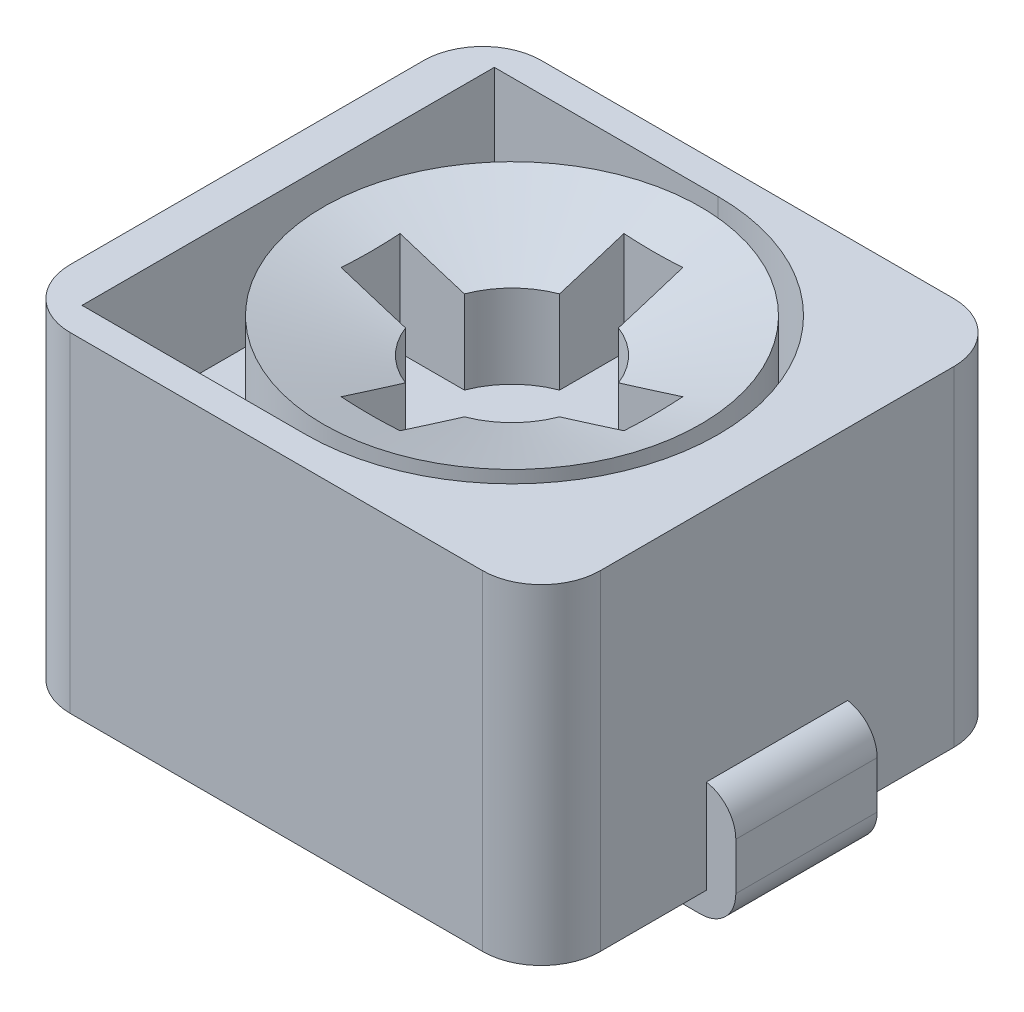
SolidWorks part; units mm, degrees
ref_plane "Front" through (0, 0, 0) normal (0, 0, 1) x (1, 0, 0)
ref_plane "Top" through (0, 0, 0) normal (0, 1, 0) x (1, 0, 0)
ref_plane "Right" through (0, 0, 0) normal (1, 0, 0) x (0, 0, -1)
sketch "Эскиз1" plane through (0, 0, 0) normal (0, 0, 1) x (1, 0, 0)
  line L0 (1.35, 0) -> (2.2, 0)
  line L1 (-2.2, 0) -> (-1.35, 0)
  line L2 (-2.5, 0.3) -> (-2.5, 0.7)
  line L3 (-2.2, 1) -> (2.2, 1)
  line L4 (2.5, 0.3) -> (2.5, 0.7)
  line L5 (0, 1) -> (0, 0.9) construction
  line L6 (-1.35, 0) -> (-1.35, 0.9)
  line L7 (-1.35, 0.9) -> (1.35, 0.9)
  line L8 (1.35, 0) -> (1.35, 0.9)
  arc A0 (-2.2, 0) -> (-2.5, 0.3) centre (-2.2, 0.3) cw
  arc A1 (-2.5, 0.7) -> (-2.2, 1) centre (-2.2, 0.7) cw
  arc A2 (2.2, 1) -> (2.5, 0.7) centre (2.2, 0.7) cw
  arc A3 (2.2, 0) -> (2.5, 0.3) centre (2.2, 0.3) ccw
  dimension "D6" = 0.3
  dimension "D1" = 5
  dimension "D2" = 2.7
  dimension "D4" = 0.9
  dimension "D5" = 1
extrude "Вытянуть1" add sketch "Эскиз1" along normal mid plane 1.2
sketch "Эскиз2" plane through (0, 0, 0) normal (0, 1, 0) x (1, 0, 0)
  line L0 (0, -2) -> (0, 2) construction
  line L1 (-1.75, -2) -> (1.75, -2)
  line L2 (-2.25, -1.5) -> (-2.25, 1.5)
  line L3 (-1.75, 2) -> (1.75, 2)
  line L4 (2.25, -1.5) -> (2.25, 1.5)
  arc A0 (-2.25, 1.5) -> (-1.75, 2) centre (-1.75, 1.5) cw
  arc A1 (-1.75, -2) -> (-2.25, -1.5) centre (-1.75, -1.5) cw
  arc A2 (1.75, -2) -> (2.25, -1.5) centre (1.75, -1.5) ccw
  arc A3 (1.75, 2) -> (2.25, 1.5) centre (1.75, 1.5) cw
  point P7 (-2.25, 2)
  point P10 (-2.25, -2)
  point P13 (2.25, -2)
  dimension "D3" = 0.5
  dimension "D1" = 4.5
  dimension "D2" = 4
extrude "Вытянуть2" add sketch "Эскиз2" along normal blind 2.8 from offset 0.2
sketch "Эскиз3" plane through (0, 3, 0) normal (0, 1, 0) x (-1, 0, 0)
  line L0 (0, -2) -> (0, 0) construction
  line L1 (-1.75, -2) -> (1.75, -2) construction
  line L2 (-0.6538, 0.25) -> (-1.2, 0.25)
  line L3 (-1.2, -0.25) -> (-1.2, 0.25)
  line L4 (0.25, -0.6538) -> (0.25, -1.2)
  line L5 (0.25, -1.2) -> (-0.25, -1.2)
  line L6 (-0.25, -0.6538) -> (-0.25, -1.2)
  line L7 (-0.6538, -0.25) -> (-1.2, -0.25)
  line L8 (0.25, 0.6538) -> (0.25, 1.2)
  line L9 (-0.25, 1.2) -> (0.25, 1.2)
  line L10 (-0.25, 0.6538) -> (-0.25, 1.2)
  line L11 (0.6538, -0.25) -> (1.2, -0.25)
  line L12 (1.2, 0.25) -> (1.2, -0.25)
  line L13 (0.6538, 0.25) -> (1.2, 0.25)
  line L15 (0, -1.75) -> (1.9, -1.75)
  line L17 (0, 1.75) -> (1.9, 1.75)
  line L18 (1.9, -1.75) -> (1.9, 1.75)
  circle A0 centre (0, 0) radius 1.6
  arc A1 (0.25, -0.6538) -> (0.6538, -0.25) centre (0, 0) ccw
  arc A2 (0.6538, 0.25) -> (0.25, 0.6538) centre (0, 0) ccw
  arc A3 (-0.25, 0.6538) -> (-0.6538, 0.25) centre (0, 0) ccw
  arc A4 (-0.6538, -0.25) -> (-0.25, -0.6538) centre (0, 0) ccw
  arc A5 (0, 1.75) -> (0, -1.75) centre (0, 0) ccw
  dimension "D3" = 0.7
  dimension "D4" = 3.2
  dimension "D1" = 0.5
  dimension "D2" = 2.4
  dimension "D5" = 3.5
  dimension "D6" = 1.9
extrude "Вырез-Вытянуть1" cut sketch "Эскиз3" against normal blind 1
sketch "Эскиз4" plane through (0, 3, 0) normal (0, 1, 0) x (-1, 0, 0)
  circle A0 centre (0, 0) radius 1.6 construction
  circle A1 centre (0, 0) radius 1.6
extrude "Вырез-Вытянуть2" cut sketch "Эскиз4" against normal blind 0.3 draft 72
